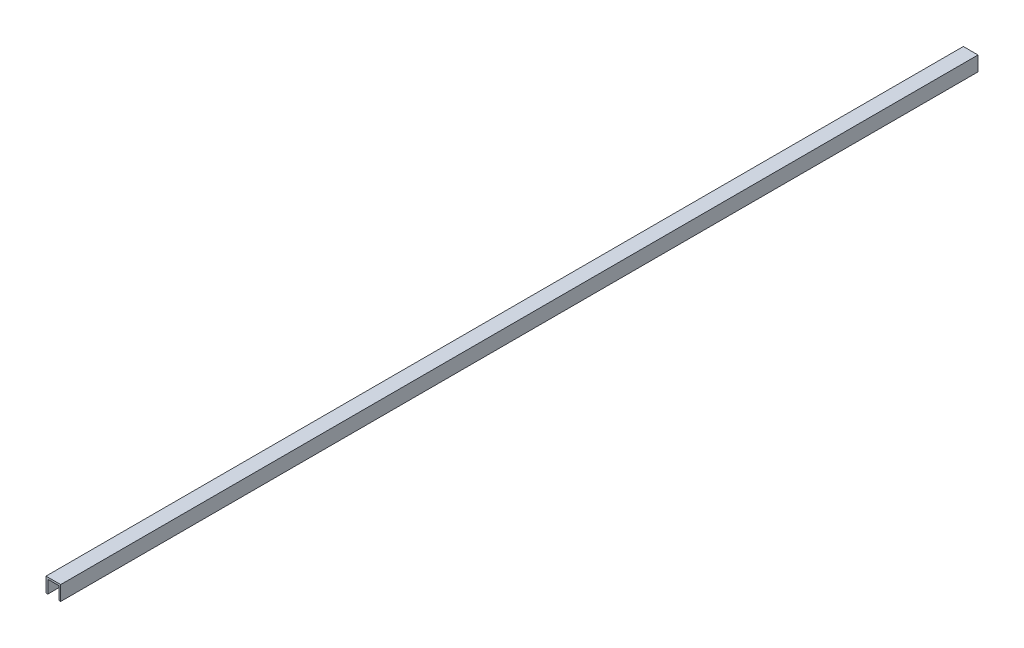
SolidWorks part; units mm, degrees
ref_plane "Ebene vorne" through (0, 0, 0) normal (0, 0, 1) x (1, 0, 0)
ref_plane "Ebene oben" through (0, 0, 0) normal (0, 1, 0) x (1, 0, 0)
ref_plane "Ebene rechts" through (0, 0, 0) normal (1, 0, 0) x (0, 0, -1)
sketch "Skizze1" plane through (0, 0, 0) normal (0, 0, 1) x (1, 0, 0)
  line L1 (4, -4) -> (-4, -4)
  line L2 (4, -4) -> (4, 4)
  line L3 (4, 4) -> (-4, 4)
  line L4 (-4, -4) -> (-4, 4)
  line L5 (4, -4) -> (-4, 4) construction
  line L6 (4, 4) -> (-4, -4) construction
  point P0 (0, 0)
  dimension "D1" = 8
extrude "Aufsatz-Linear austragen1" add sketch "Skizze1" along normal mid plane 500 contours L3 L4 L1 L2
shell "Wandung1" thickness 1
